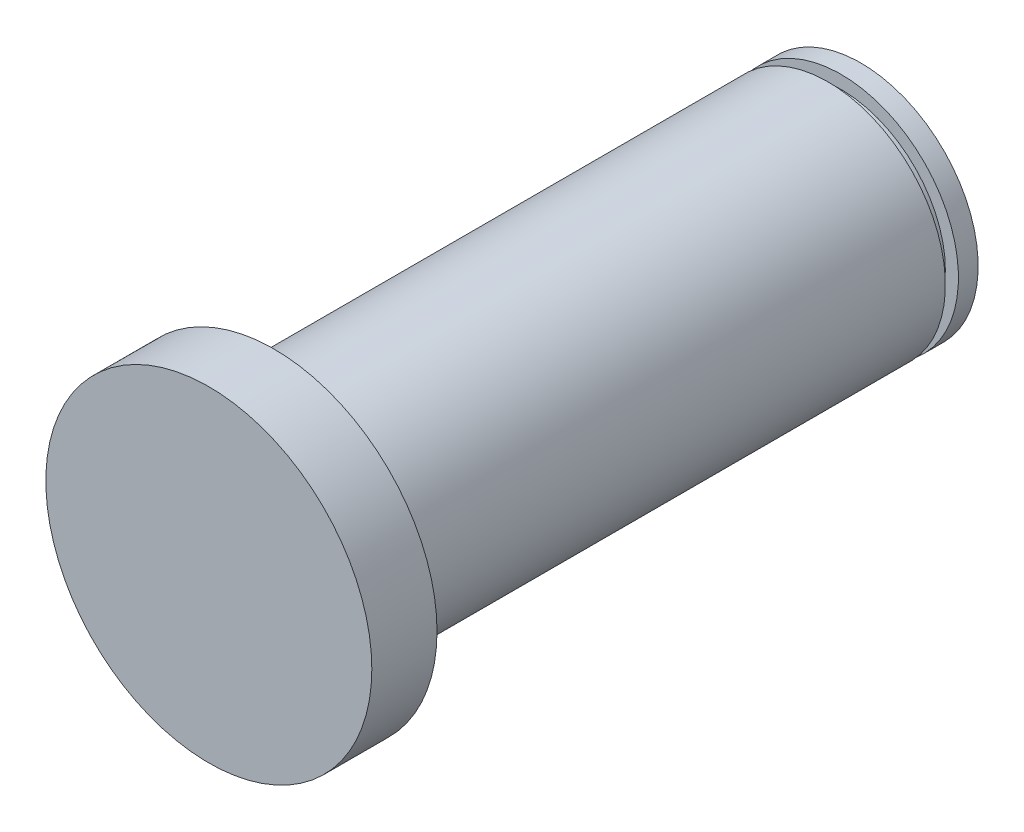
SolidWorks part; units mm, degrees
ref_plane "Plan de face" through (0, 0, 0) normal (0, 0, 1) x (1, 0, 0)
ref_plane "Plan de dessus" through (0, 0, 0) normal (0, 1, 0) x (1, 0, 0)
ref_plane "Plan de droite" through (0, 0, 0) normal (1, 0, 0) x (0, 0, -1)
sketch "Esquisse1" plane through (0, 0, 0) normal (0, 0, 1) x (1, 0, 0)
  circle A0 centre (0, 0) radius 9
  dimension "D1" = 18
extrude "Boss.-Extru.1" add sketch "Esquisse1" along normal blind 45
sketch "Esquisse2" plane through (0, 0, 45) normal (0, 0, 1) x (1, 0, 0)
  circle A0 centre (0, 0) radius 12.5
  dimension "D1" = 25
extrude "Boss.-Extru.2" add sketch "Esquisse2" along normal blind 5
sketch "Esquisse3" plane through (0, 0, 0) normal (1, 0, 0) x (0, 0, -1)
  line L0 (0, 9) -> (-45, 9) construction
  line L1 (-1.5138, 9) -> (-2.5138, 9)
  line L2 (-1.5138, 9) -> (-1.5138, 8)
  line L3 (-1.5138, 8) -> (-2.5138, 8)
  line L4 (-2.5138, 9) -> (-2.5138, 8)
  dimension "D1" = 1
  dimension "D2" = 1
revolve "Enlèvement de matière-Révolution1" cut sketch "Esquisse3" angle 360 about axis through (0, 0, 45) along (0, 0, -1)
